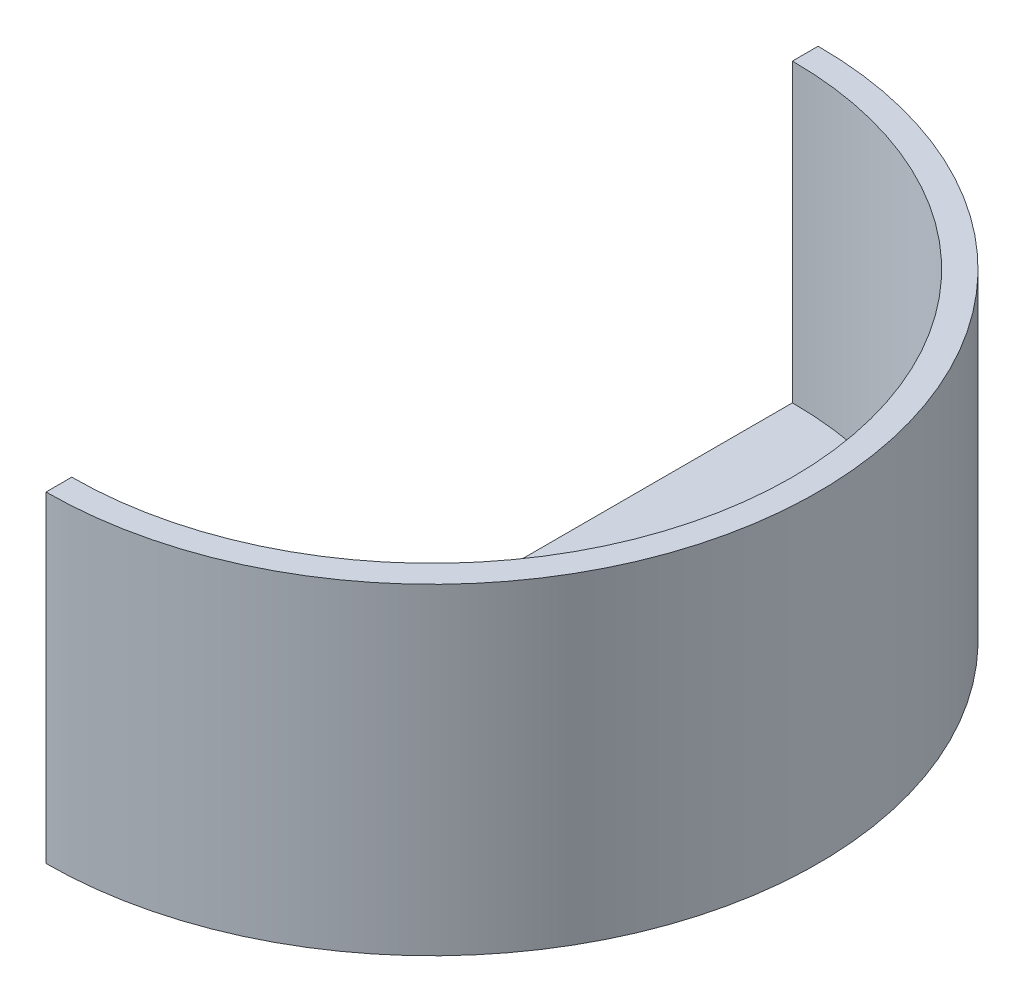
SolidWorks part; units mm, degrees
ref_plane "Front Plane" through (0, 0, 0) normal (0, 0, 1) x (1, 0, 0)
ref_plane "Top Plane" through (0, 0, 0) normal (0, 1, 0) x (1, 0, 0)
ref_plane "Right Plane" through (0, 0, 0) normal (1, 0, 0) x (0, 0, -1)
sketch "Sketch1" plane through (0, 0, 0) normal (0, 1, 0) x (1, 0, 0)
  line L0 (15, -30) -> (15, 30)
  arc A0 (15, -30) -> (15, 30) centre (15, 0) ccw
  dimension "D2" = 30
extrude "Extrude1" add sketch "Sketch1" along normal blind 25
shell "Shell1" thickness 2
ref_plane "Plane1" through (70, 0, 0) normal (1, 0, 0) x (0, 0, -1)
sketch "Sketch2" plane through (70, 0, 0) normal (1, 0, 0) x (0, 0, -1)
  line L0 (-12.364, 19.864) -> (-12.364, 5.136)
  line L1 (-6, 2.5) -> (6, 2.5)
  line L2 (-15, 11.5) -> (-15, 13.5)
  line L3 (-6, 22.5) -> (6, 22.5)
  line L4 (15, 11.5) -> (15, 13.5)
  line L5 (-6, 22.5) -> (-6, 2.5)
  line L6 (0, 22.5) -> (0, 2.5)
  line L7 (6, 22.5) -> (6, 2.5)
  line L8 (12.364, 19.864) -> (12.364, 5.136)
  line L9 (-14.3684, 16.8121) -> (14.3684, 16.8121)
  line L10 (-15, 12.5) -> (15, 12.5)
  line L11 (-14.3684, 8.1879) -> (14.3684, 8.1879)
  arc A0 (-15, 13.5) -> (-6, 22.5) centre (-6, 13.5) cw
  arc A1 (-6, 2.5) -> (-15, 11.5) centre (-6, 11.5) cw
  arc A2 (6, 2.5) -> (15, 11.5) centre (6, 11.5) ccw
  arc A3 (6, 22.5) -> (15, 13.5) centre (6, 13.5) cw
  point P7 (-15, 22.5)
  point P10 (-15, 2.5)
  point P15 (15, 22.5)
  dimension "D6" = 9
  dimension "D1" = 30
  dimension "D2" = 20
  dimension "D3" = 15
  dimension "D4" = 2.5
